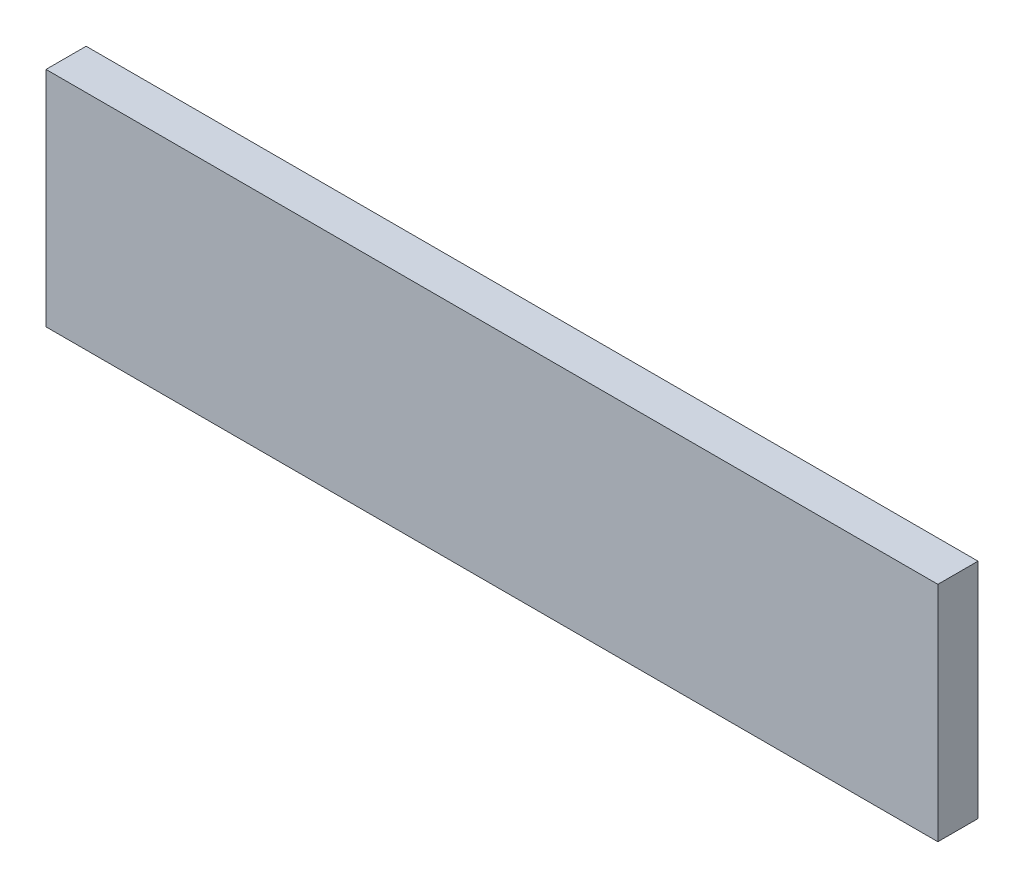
SolidWorks part; units mm, degrees
ref_plane "Front Plane" through (0, 0, 0) normal (0, 0, 1) x (1, 0, 0)
ref_plane "Top Plane" through (0, 0, 0) normal (0, 1, 0) x (1, 0, 0)
ref_plane "Right Plane" through (0, 0, 0) normal (1, 0, 0) x (0, 0, -1)
sketch "Sketch1" plane through (0, 0, 0) normal (0, 0, 1) x (1, 0, 0)
  line L0 (0, 0) -> (211.3366, 0) construction
  line L1 (0, 0) -> (0, 78.9562) construction
  line L2 (40, 5) -> (40, -5)
  line L3 (0, -5) -> (40, -5)
  line L4 (0, -5) -> (0, 5)
  line L5 (0, 5) -> (40, 5)
  dimension "D2" = 10
  dimension "D3" = 5
  dimension "D6" = 40
extrude "Extrude1" add sketch "Sketch1" along normal blind 1.8
